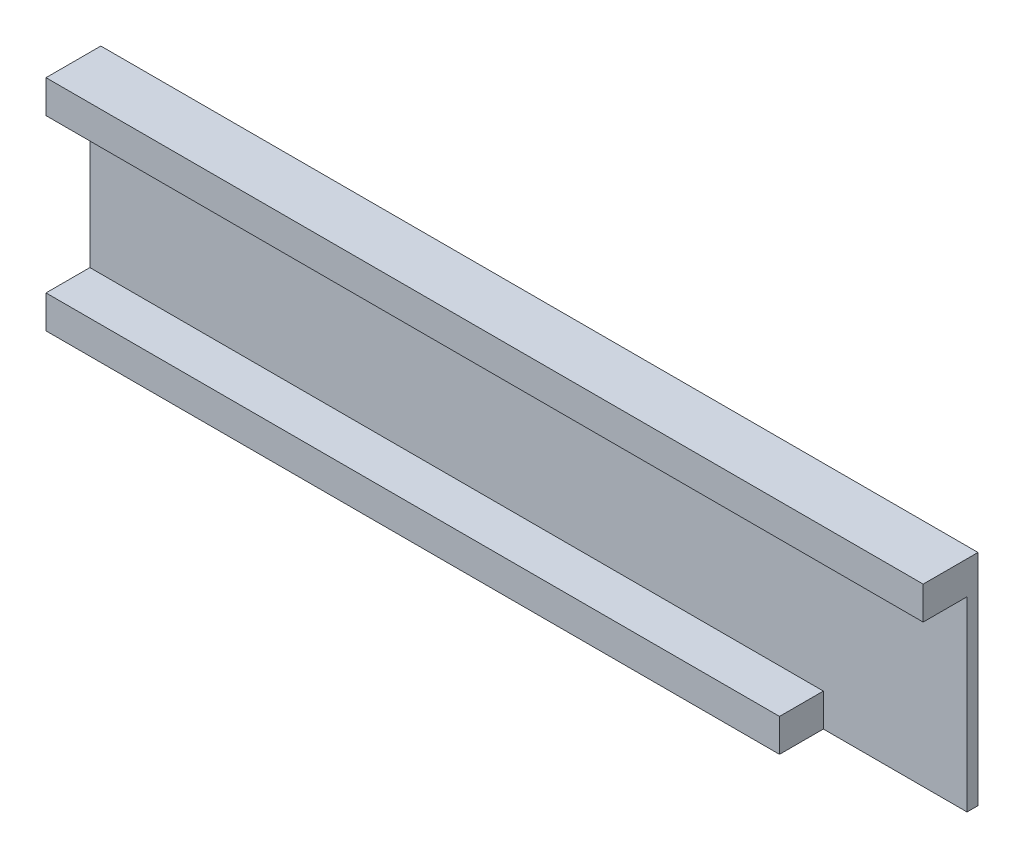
SolidWorks part; units mm, degrees
ref_plane "前视基准面" through (0, 0, 0) normal (0, 0, 1) x (1, 0, 0)
ref_plane "上视基准面" through (0, 0, 0) normal (0, 1, 0) x (1, 0, 0)
ref_plane "右视基准面" through (0, 0, 0) normal (1, 0, 0) x (0, 0, -1)
sketch "草图1" plane through (0, 0, 0) normal (0, 0, 1) x (1, 0, 0)
  line L1 (-14.2759, 5.7241) -> (25.7241, 5.7241)
  line L2 (-14.2759, 5.7241) -> (-14.2759, -4.2759)
  line L3 (-14.2759, -4.2759) -> (25.7241, -4.2759)
  line L4 (25.7241, 5.7241) -> (25.7241, -4.2759)
  dimension "D1" = 10
  dimension "D2" = 40
extrude "凸台-拉伸1" add sketch "草图1" along normal blind 0.5
sketch "草图2" plane through (0, 0, 0) normal (0, 0, -1) x (-1, 0, 0)
  line L0 (-24.087, 0.0093) -> (7.7796, 0.1718)
  line L1 (7.7796, 0.1718) -> (12.5254, 2.5463)
  line L2 (12.5254, 2.5463) -> (7.7796, 0.1718) construction
  line L3 (-19.0164, 2.5463) -> (12.5254, 2.5463) construction
  line L4 (12.5254, 2.5463) -> (-19.0164, 2.5463)
  line L5 (-19.0164, 2.5463) -> (-24.087, 0.0093)
extrude "凸台-拉伸2" add sketch "草图2" along normal up to vertex (1.4754 mm away)
sketch "草图3" plane through (0, 0, 0.5) normal (0, 0, 1) x (1, 0, 0)
  line L0 (-14.2759, 5.7241) -> (-14.2759, -4.2759) construction
  line L1 (-14.2759, 3.2241) -> (25.7241, 3.2241)
  line L3 (-14.2759, -1.7759) -> (19.1732, -1.7759)
  line L6 (25.7241, 5.7241) -> (-14.2759, 5.7241) construction
  line L7 (-14.2759, -4.2759) -> (25.7241, -4.2759) construction
  line L8 (19.1732, -1.7759) -> (19.1732, -4.2759)
  line L9 (-14.2759, 5.7241) -> (25.7241, 5.7241)
  line L10 (-14.2759, 5.7241) -> (-14.2759, 3.2241)
  line L11 (-14.2759, 3.2241) -> (25.7241, 3.2241)
  line L12 (25.7241, 5.7241) -> (25.7241, 3.2241)
  line L13 (-14.2759, -1.7759) -> (19.1732, -1.7759)
  line L14 (-14.2759, -1.7759) -> (-14.2759, -4.2759)
  line L15 (-14.2759, -4.2759) -> (19.1732, -4.2759)
  dimension "D1" = 2.5
  dimension "D2" = 2.5
extrude "凸台-拉伸3" add sketch "草图3" along normal blind 2 contours L1 M3 M5 M6 | L3 M3 M4 M5
sketch "草图4" plane through (0, 0, -1.4754) normal (0, 0, -1) x (-1, 0, 0)
  line L0 (-18.9691, 2.3463) -> (-23.2315, 0.2137)
  line L1 (-23.2315, 0.2137) -> (7.7319, 0.3716)
  line L2 (7.7319, 0.3716) -> (11.6787, 2.3463)
  line L3 (11.6787, 2.3463) -> (-18.9691, 2.3463)
  line L4 (-19.0164, 2.5463) -> (-24.087, 0.0093)
  line L5 (-24.087, 0.0093) -> (7.7796, 0.1718)
  line L6 (7.7796, 0.1718) -> (12.5254, 2.5463)
  line L7 (12.5254, 2.5463) -> (-19.0164, 2.5463)
  line L8 (-19.0164, 2.5463) -> (-24.087, 0.0093)
  line L9 (-24.087, 0.0093) -> (7.7796, 0.1718)
  line L10 (7.7796, 0.1718) -> (12.5254, 2.5463)
  line L11 (12.5254, 2.5463) -> (-19.0164, 2.5463)
  dimension "D1" = 0
  dimension "D2" = 0.2
extrude "切除-拉伸1" cut sketch "草图4" against normal up to vertex (1.4754 mm away)
sketch "草图5" plane through (0, 0, 0.5) normal (0, 0, 1) x (1, 0, 0)
  line L0 (-14.2759, 4.2241) -> (25.7241, 4.2241)
  line L1 (-14.2759, -2.7759) -> (19.1732, -2.7759)
  line L3 (-14.2759, 3.2241) -> (25.7241, 3.2241) construction
  line L4 (-14.2759, -1.7759) -> (19.1732, -1.7759) construction
  line L5 (-14.2759, 3.2241) -> (-14.2759, 4.2241)
  line L6 (-14.2759, 5.7241) -> (-14.2759, 3.2241) construction
  line L7 (-14.2759, 3.2241) -> (25.7241, 3.2241)
  line L8 (25.7241, 3.2241) -> (25.7241, 4.2241)
  line L9 (25.7241, 3.2241) -> (25.7241, 5.7241) construction
  line L10 (-14.2759, -1.7759) -> (-14.2759, -2.7759)
  line L11 (-14.2759, -1.7759) -> (-14.2759, -4.2759) construction
  line L12 (-14.2759, -1.7759) -> (19.1732, -1.7759)
  line L13 (19.1732, -1.7759) -> (19.1732, -2.7759)
  line L14 (19.1732, -1.7759) -> (19.1732, -4.2759) construction
  dimension "D1" = 1
  dimension "D2" = 1
extrude "切除-拉伸2" cut sketch "草图5" along normal through all
